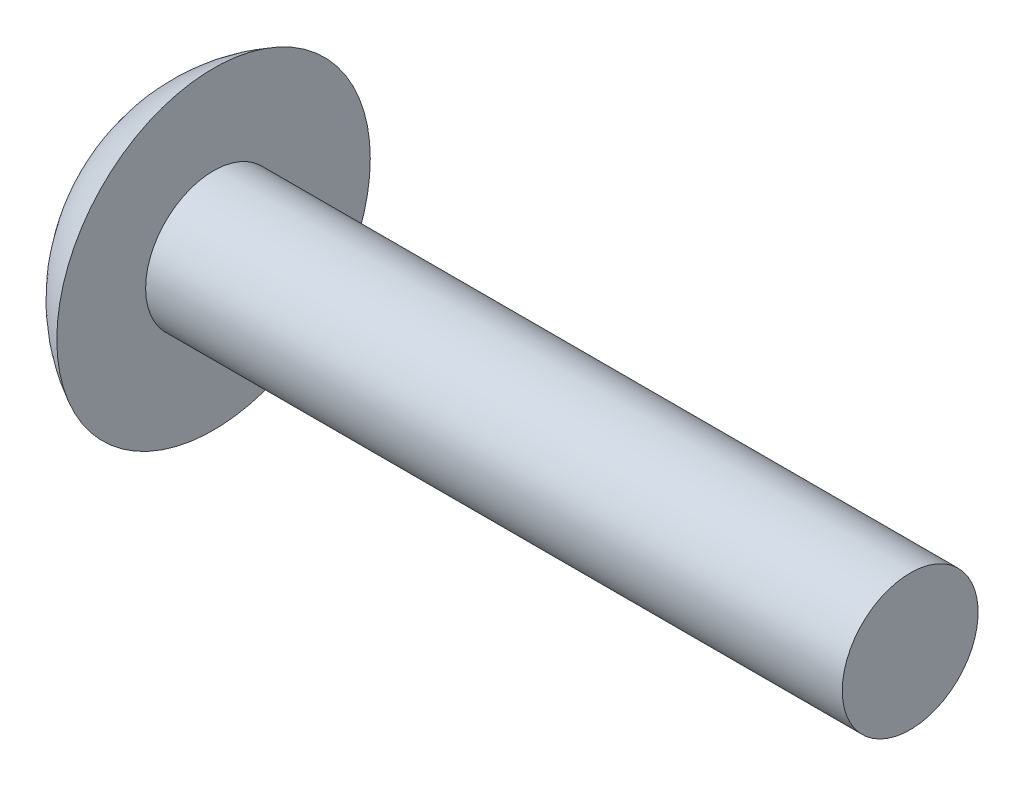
SolidWorks part; units mm, degrees
ref_plane "Plan1" through (0, 0, 0) normal (0, 0, 1) x (1, 0, 0)
ref_plane "Plan2" through (0, 0, 0) normal (0, 1, 0) x (1, 0, 0)
ref_plane "Plan3" through (0, 0, 0) normal (1, 0, 0) x (0, 0, -1)
sketch "Esquisse1" plane through (0, 0, 0) normal (0, 0, 1) x (1, 0, 0)
  line L0 (-40, 0) -> (64, 0) construction
  line L1 (49, 0) -> (49, 3.9)
  line L2 (49, 3.9) -> (9, 3.9)
  line L3 (9, 3.9) -> (9, 9)
  line L4 (49, 0) -> (4, 0)
  arc A0 (4, 0) -> (9, 9) centre (13.25, 0.75) cw
  dimension "D1" = 40
  dimension "D2" = 3.9
revolve "Base-Révolution" add sketch "Esquisse1" angle 360 about L0
sketch "Esquisse2" plane through (0, 0, 0) normal (1, 0, 0) x (0, 0, -1)
  line L0 (-1.3469, 2.5) -> (1.5451, 2.5)
  line L1 (1.5451, 2.5) -> (2.8384, -0.0866)
  line L2 (2.8384, -0.0866) -> (1.245, -2.5)
  line L3 (1.245, -2.5) -> (-1.647, -2.5)
  line L4 (-1.647, -2.5) -> (-2.9403, 0.0866)
  line L5 (-2.9403, 0.0866) -> (-1.3469, 2.5)
  circle A0 centre (0, 0) radius 9 construction
  dimension "D3" = 2.5
  dimension "D1" = 60
  dimension "D2" = 5
  dimension "D4" = 2.5
extrude "Enlèv. mat.-Extru.1" cut sketch "Esquisse2" along normal blind 7
